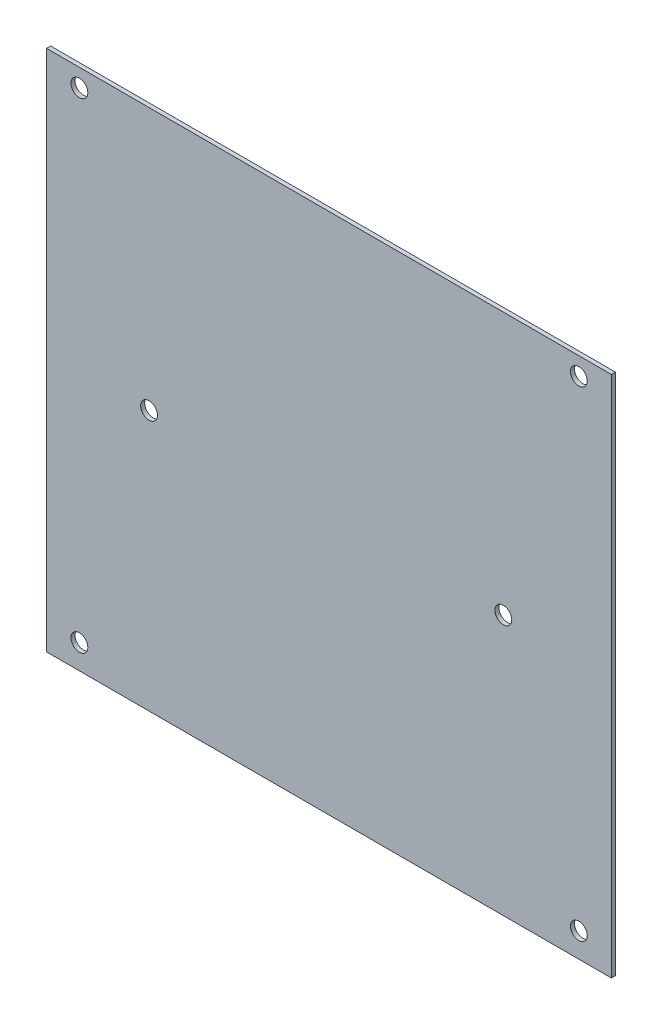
SolidWorks part; units mm, degrees
ref_plane "Front Plane" through (0, 0, 0) normal (0, 0, 1) x (1, 0, 0)
ref_plane "Top Plane" through (0, 0, 0) normal (0, 1, 0) x (1, 0, 0)
ref_plane "Right Plane" through (0, 0, 0) normal (1, 0, 0) x (0, 0, -1)
sketch "Sketch1" plane through (0, 0, 0) normal (0, 0, 1) x (1, 0, 0)
  line L1 (0, 0) -> (97.25, 0)
  line L2 (0, 0) -> (0, 90)
  line L3 (0, 90) -> (97.25, 90)
  line L4 (97.25, 0) -> (97.25, 90)
extrude "Boss-Extrude1" add sketch "Sketch1" along normal blind 2 contours L3 L4 L1 L2
sketch "Sketch2" plane through (0, 0, 0) normal (0, 0, -1) x (-1, 0, 0)
  line L1 (-91.65, 4.225) -> (-5.65, 4.225) construction
  line L2 (-91.65, 4.225) -> (-91.65, 86.925) construction
  line L3 (-91.65, 86.925) -> (-5.65, 86.925) construction
  line L4 (-5.65, 4.225) -> (-5.65, 86.925) construction
  line L5 (-91.65, 4.225) -> (-5.65, 86.925) construction
  line L6 (-91.65, 86.925) -> (-5.65, 4.225) construction
  circle A0 centre (-5.65, 86.925) radius 1.025
  circle A1 centre (-91.65, 86.925) radius 1.025
  circle A2 centre (-17.65, 44.825) radius 1.025
  circle A3 centre (-78.65, 44.825) radius 1.025
  circle A4 centre (-5.65, 4.225) radius 1.025
  circle A5 centre (-91.65, 4.225) radius 1.025
  point P18 (-48.65, 45.575)
extrude "Cut-Extrude1" cut sketch "Sketch2" against normal blind 2
hole_wizard "CSK for M2.5 Flat Head Machine Screw1" positions "Sketch4" profile "Sketch3" countersink size "M2.5" standard "ANSI Metric"
sketch "Sketch4" plane through (0, 0, 2) normal (0, 0, 1) x (1, 0, 0)
  point P0 (91.65, 86.925)
  point P3 (5.65, 86.925)
  point P6 (17.65, 44.825)
  point P9 (5.65, 4.225)
  point P12 (91.65, 4.225)
  point P15 (78.65, 44.825)
sketch "Sketch3" plane through (91.65, 86.925, 2) normal (1, 0, 0) x (0, -1, 0)
  line L0 (0, 0) -> (0, 2)
  line L1 (0, 2) -> (1.45, 2)
  line L2 (1.45, 2) -> (1.45, 1.3)
  line L3 (1.45, 1.3) -> (2.75, 0)
  line L5 (2.75, 0) -> (0, 0)
  line L6 (-1.45, 1.3) -> (-2.75, 0) construction
  line L11 (0, -6.35) -> (0, 107.95) construction
  dimension "Thru Hole Dia." = 2.9
  dimension "Thru Hole Depth" = 2
  dimension "Near C'Sink Dia." = 5.5
  dimension "Near C'Sink Angle" = 90
sketch "Sketch5" plane through (0, 0, 2) normal (0, 0, 1) x (1, 0, 0)
  line L1 (0, 90) -> (97.25, 90)
  line L2 (0, 90) -> (0, 0)
  line L3 (0, 0) -> (97.25, 0)
  line L4 (97.25, 90) -> (97.25, 0)
extrude "Cut-Extrude2" cut sketch "Sketch5" against normal offset from surface (1.3 mm away) 0.7
